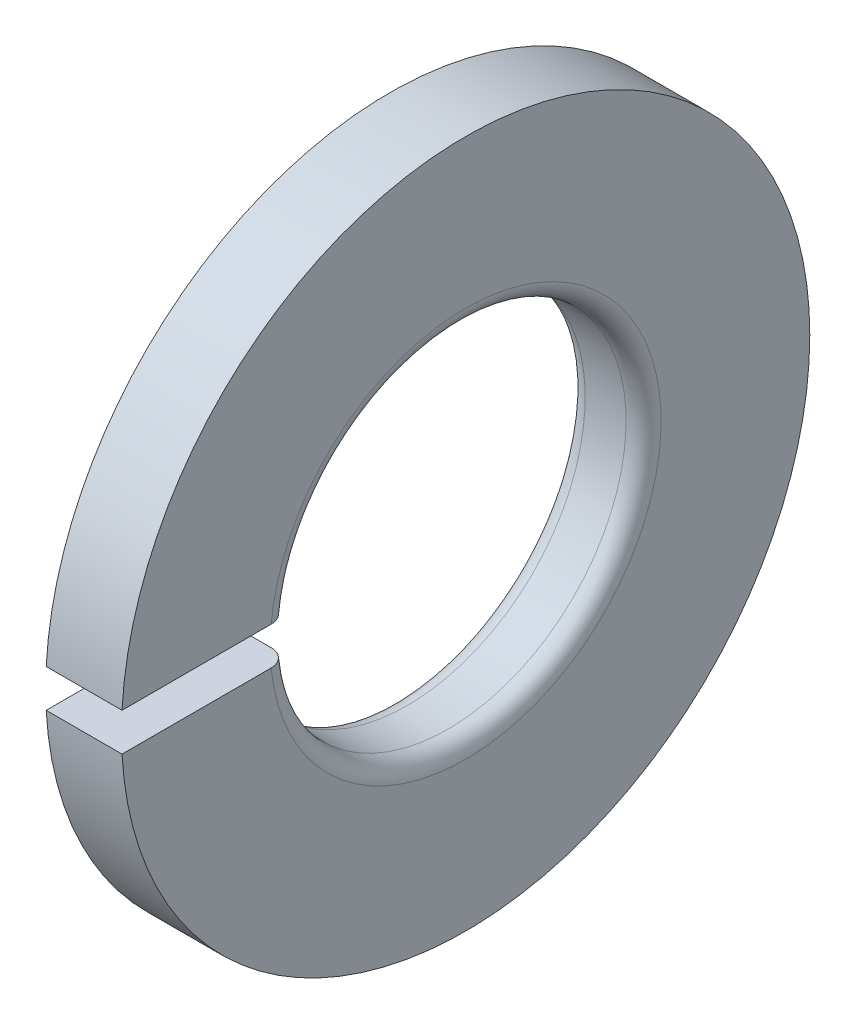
SolidWorks part; units mm, degrees
ref_plane "Plane1" through (0, 0, 0) normal (0, 0, 1) x (1, 0, 0)
ref_plane "Plane2" through (0, 0, 0) normal (0, 1, 0) x (1, 0, 0)
ref_plane "Plane3" through (0, 0, 0) normal (1, 0, 0) x (0, 0, -1)
revolve "Base-Revolve" add sketch "Sketch1" angle 360 about L0
sketch "Sketch1" plane through (0, 0, 0) normal (0, 0, 1) x (1, 0, 0)
  line L0 (-34.925, 0) -> (9.525, 0) construction
  line L1 (0, 3.35) -> (0, 5.9)
  line L2 (0, 5.9) -> (-1.3, 5.9)
  line L3 (-1.3, 5.9) -> (-1.3, 3.35)
  line L4 (-1, 3.05) -> (-0.3, 3.05)
  arc A0 (-1, 3.05) -> (-1.3, 3.35) centre (-1, 3.35) cw
  arc A1 (0, 3.35) -> (-0.3, 3.05) centre (-0.3, 3.35) cw
  point P8 (-1.3, 3.05)
  dimension "Fillet_rad" = 0.3
  dimension "D1" = 0.3
  dimension "Thickness" = 1.3
  dimension "Inside_dia" = 6.1
  dimension "Outside_dia" = 11.8
extrude "Gap" cut sketch "Sketch2" along normal through all
sketch "Sketch2" plane through (0, 0, 0) normal (-1, 0, 0) x (0, -1, 0)
  line L0 (-0.325, 0) -> (0.325, 0)
  line L1 (0, 0) -> (0, 12.7) construction
  line L2 (0.325, 0) -> (0.325, 6.018)
  line L3 (0.325, 6.018) -> (-0.325, 6.018)
  line L4 (-0.325, 6.018) -> (-0.325, 0)
  dimension "D1" = 0.65
  dimension "D2" = 6.018
equation "\"D1@Sketch1\" = \"Fillet_rad@Sketch1\""
equation "\"D1@Sketch2\" = \"Thickness@Sketch1\" * 0.5"
equation "\"D2@Sketch2\" = \"Outside_dia@Sketch1\" * 0.51"
